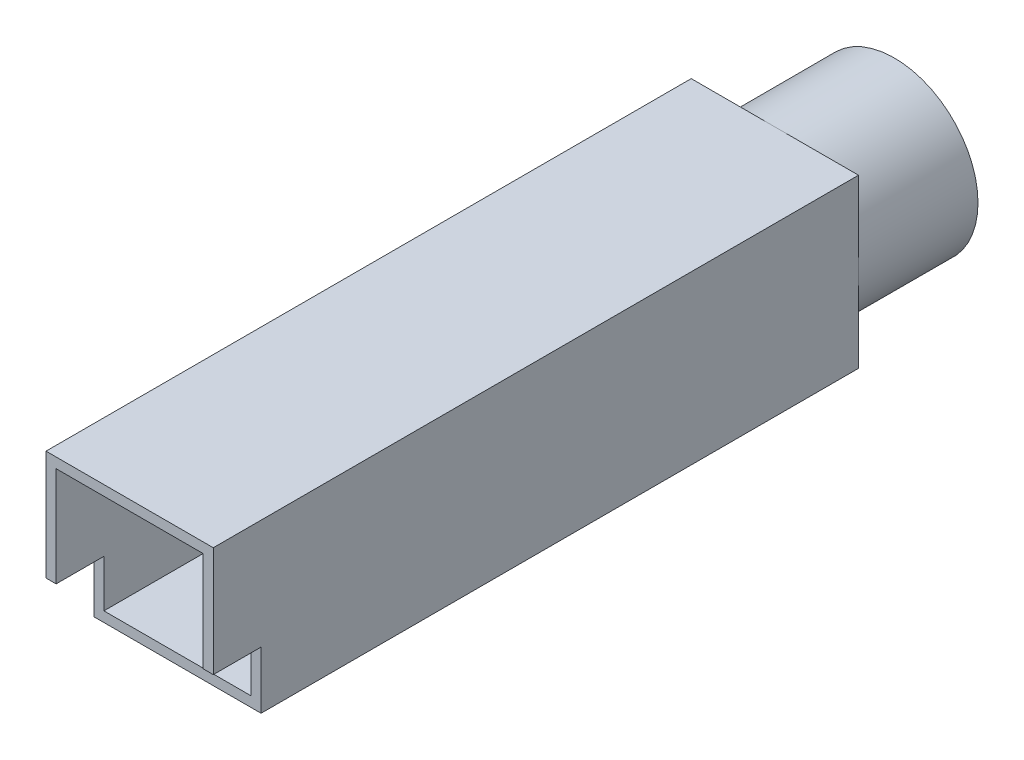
SolidWorks part; units mm, degrees
ref_plane "Front Plane" through (0, 0, 0) normal (0, 0, 1) x (1, 0, 0)
ref_plane "Top Plane" through (0, 0, 0) normal (0, 1, 0) x (1, 0, 0)
ref_plane "Right Plane" through (0, 0, 0) normal (1, 0, 0) x (0, 0, -1)
sketch "Sketch2" plane through (0, 0, 0) normal (0, 0, 1) x (1, 0, 0)
  circle A0 centre (0, 0) radius 16
  circle A1 centre (0, 0) radius 17.5
  dimension "D1" = 32
  dimension "D2" = 35
extrude "Boss-Extrude1" add sketch "Sketch2" along normal blind 25
sketch "Sketch3" plane through (0, 0, 25) normal (0, 0, 1) x (1, 0, 0)
  line L1 (-17.5, -17.5) -> (17.5, -17.5)
  line L2 (-17.5, -17.5) -> (-17.5, 17.5)
  line L3 (-17.5, 17.5) -> (17.5, 17.5)
  line L4 (17.5, -17.5) -> (17.5, 17.5)
  line L5 (-17.5, -17.5) -> (17.5, 17.5) construction
  line L6 (-17.5, 17.5) -> (17.5, -17.5) construction
  line L7 (-15.3825, -15.3825) -> (15.3825, -15.3825)
  line L8 (-15.3825, -15.3825) -> (-15.3825, 15.3825)
  line L9 (-15.3825, 15.3825) -> (15.3825, 15.3825)
  line L10 (15.3825, -15.3825) -> (15.3825, 15.3825)
  line L11 (-15.3825, -15.3825) -> (15.3825, 15.3825) construction
  line L12 (-15.3825, 15.3825) -> (15.3825, -15.3825) construction
  point P0 (0, 0)
  point P5 (0, 0)
  dimension "D1" = 35
  dimension "D2" = 35
extrude "Boss-Extrude2" add sketch "Sketch3" along normal blind 135
sketch "Sketch4" plane through (0, 0, 25) normal (0, 0, 1) x (1, 0, 0)
  line L1 (-15.3825, -15.3825) -> (15.3825, -15.3825)
  line L2 (-15.3825, -15.3825) -> (-15.3825, 15.3825)
  line L3 (-15.3825, 15.3825) -> (15.3825, 15.3825)
  line L4 (15.3825, -15.3825) -> (15.3825, 15.3825)
  line L5 (-15.3825, -15.3825) -> (15.3825, 15.3825) construction
  line L6 (-15.3825, 15.3825) -> (15.3825, -15.3825) construction
  line L7 (-8.6484, -8.6484) -> (8.6484, -8.6484)
  line L8 (-8.6484, -8.6484) -> (-8.6484, 8.6484)
  line L9 (-8.6484, 8.6484) -> (8.6484, 8.6484)
  line L10 (8.6484, -8.6484) -> (8.6484, 8.6484)
  line L11 (-8.6484, -8.6484) -> (8.6484, 8.6484) construction
  line L12 (-8.6484, 8.6484) -> (8.6484, -8.6484) construction
  point P0 (0, 0)
  point P5 (0, 0)
extrude "Boss-Extrude3" add sketch "Sketch4" along normal blind 1
sketch "Sketch6" plane through (0, -17.5, 0) normal (0, -1, 0) x (1, 0, 0)
  line L1 (-17.5, 150) -> (17.5, 150)
  line L2 (-17.5, 150) -> (-17.5, 160)
  line L3 (-17.5, 160) -> (17.5, 160)
  line L4 (17.5, 150) -> (17.5, 160)
  line L5 (-17.5, 150) -> (17.5, 160) construction
  line L6 (-17.5, 160) -> (17.5, 150) construction
  point P0 (0, 155)
  dimension "D1" = 10
extrude "Cut-Extrude1" cut sketch "Sketch6" against normal blind 12
